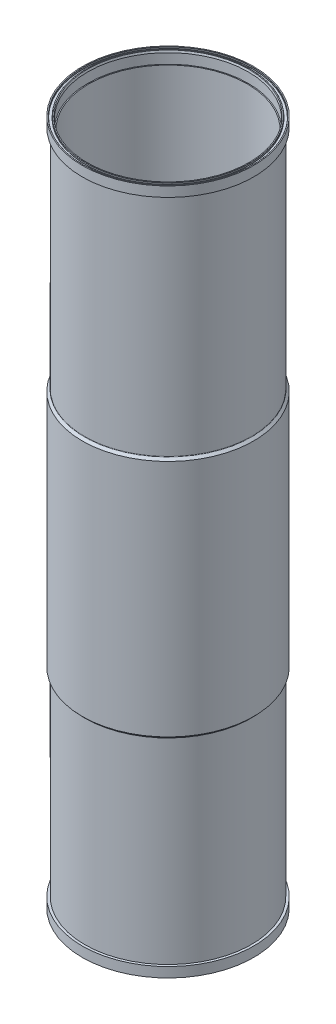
SolidWorks part; units mm, degrees
other "Static 2D"
ref_plane "Front Plane" through (0, 0, 0) normal (0, 0, 1) x (1, 0, 0)
ref_plane "Top Plane" through (0, 0, 0) normal (0, 1, 0) x (1, 0, 0)
ref_plane "Right Plane" through (0, 0, 0) normal (1, 0, 0) x (0, 0, -1)
ref_axis "Axis1" through (0, 880.11, 0) along (0, -1, 0)
sketch "Sketch1" plane through (0, 0, 0) normal (0, 0, 1) x (1, 0, 0)
  line L0 (0, 0) -> (0, 324.6281) construction
  line L1 (-109.5375, 876.3) -> (-103.3093, 876.3)
  line L2 (-102.6287, 873.76) -> (-102.6287, 861.06)
  line L3 (-109.5375, 0) -> (-103.3093, 0)
  line L4 (-101.3587, 861.06) -> (-101.3587, 15.24)
  line L5 (-109.5375, 876.3) -> (-109.5375, 0)
  line L6 (-102.6287, 861.06) -> (-101.3587, 861.06)
  line L7 (-102.6287, 2.54) -> (-102.6287, 15.24)
  line L8 (-102.6287, 15.24) -> (-101.3587, 15.24)
  line L9 (-103.3093, 876.3) -> (-102.6287, 873.76)
  line L10 (-109.5375, 0) -> (-119.5862, 0) construction
  line L11 (-103.3093, 0) -> (-102.6287, 2.54)
  dimension "D1" = 202.7174
  dimension "D2" = 219.075
  dimension "D3" = 15.24
  dimension "D4" = 15.24
  dimension "D5" = 15
  dimension "D6" = 876.3
  dimension "D7" = 15
  dimension "D8" = 2.54
  dimension "D9" = 2.54
  dimension "D10" = 205.2574
  dimension "D11" = 8.1788
revolve "Revolve1" add sketch "Sketch1" angle 360 about L0
sketch "Sketch4" plane through (0, 0, 0) normal (0, 0, 1) x (1, 0, 0)
  line L1 (-109.5375, 863.6) -> (-106.4387, 863.6)
  line L2 (-109.5375, 863.6) -> (-109.5375, 12.7)
  line L3 (-109.5375, 12.7) -> (-106.4387, 12.7)
  line L4 (-106.4387, 863.6) -> (-106.4387, 12.7)
  line L5 (-109.5375, 876.3) -> (-103.3093, 876.3) construction
  line L6 (-109.5375, 876.3) -> (-109.5375, 0) construction
  line L7 (-109.5375, 0) -> (-103.3093, 0) construction
  line L8 (-101.3587, 861.06) -> (-101.3587, 15.24) construction
  dimension "D1" = 5.08
  dimension "D2" = 12.7
  dimension "D3" = 12.7
revolve "Cut-Revolve2" cut sketch "Sketch4" angle 360 about axis through (0, 880.11, 0) along (0, -1, 0)
sketch "Sketch5" plane through (0, 0, 0) normal (0, 0, 1) x (1, 0, 0)
  line L0 (-108.2675, 876.3) -> (-104.4829, 876.3)
  line L1 (-104.6099, 876.173) -> (-104.6099, 874.5982)
  line L2 (-104.8639, 874.3442) -> (-107.8865, 874.3442)
  line L3 (-106.3752, 874.3442) -> (-106.3752, 876.3) construction
  line L4 (-108.1405, 876.173) -> (-108.1405, 874.5982)
  line L5 (-109.5375, 876.3) -> (-103.3093, 876.3) construction
  line L6 (0, 880.11) -> (0, -41.91) construction
  line L7 (0, 0) -> (0, 912.2666) construction
  line L8 (-109.5375, 876.3) -> (-109.5375, 0) construction
  arc A0 (-104.4829, 876.3) -> (-104.6099, 876.173) centre (-104.4829, 876.173) ccw
  arc A1 (-108.2675, 876.3) -> (-108.1405, 876.173) centre (-108.2675, 876.173) cw
  arc A2 (-108.1405, 874.5982) -> (-107.8865, 874.3442) centre (-107.8865, 874.5982) ccw
  arc A3 (-104.6099, 874.5982) -> (-104.8639, 874.3442) centre (-104.8639, 874.5982) cw
  point P21 (-108.1405, 874.3442)
  point P24 (-104.6099, 874.3442)
  dimension "D1" = 0.127
  dimension "D6" = 0.254
  dimension "D2" = 3.5306
  dimension "D3" = 1.9558
  dimension "D4" = 209.2198
  dimension "D5" = 1.397
revolve "2-172 O-Ring" cut sketch "Sketch5" angle 360 about L7
ref_plane "Plane1" through (0, 438.15, 0) normal (0, 1, 0) x (1, 0, 0)
mirror "Mirror1" about plane through (0, 438.15, 0) normal (0, 1, 0) of "2-172 O-Ring"
sketch "Sketch8" plane through (0, 0, 0) normal (0, 0, 1) x (1, 0, 0)
  line L0 (-106.4387, 863.6) -> (-106.4387, 12.7) construction
  line L1 (-109.5375, 876.3) -> (-109.5375, 863.6) construction
  line L2 (-109.5375, 266.7) -> (-106.6712, 263.8337)
  line L3 (-109.5375, 571.5) -> (-106.6712, 574.3663)
  line L4 (0, 0) -> (0, 997.0419) construction
  line L5 (109.5375, 12.7) -> (-109.5375, 12.7) construction
  line L6 (-109.5375, 863.6) -> (109.5375, 863.6) construction
  line L7 (-106.4387, 574.9276) -> (-106.4387, 263.2724)
  line L9 (-109.5375, 571.5) -> (-109.5375, 266.7)
  line L13 (-106.4387, 419.1) -> (-126.4542, 419.1) construction
  arc A0 (-106.6712, 574.3663) -> (-106.4387, 574.9276) centre (-107.2324, 574.9276) ccw
  arc A1 (-106.6712, 263.8337) -> (-106.4387, 263.2724) centre (-107.2324, 263.2724) cw
  dimension "D2" = 304.8
  dimension "D4" = 0.7937
  dimension "D1" = 254
  dimension "D3" = 45
  dimension "D5" = 292.1
revolve "Revolve2" add sketch "Sketch8" angle 360 about L4
pattern_linear "LPattern2" [suppressed] count 4 spacing 177.8
